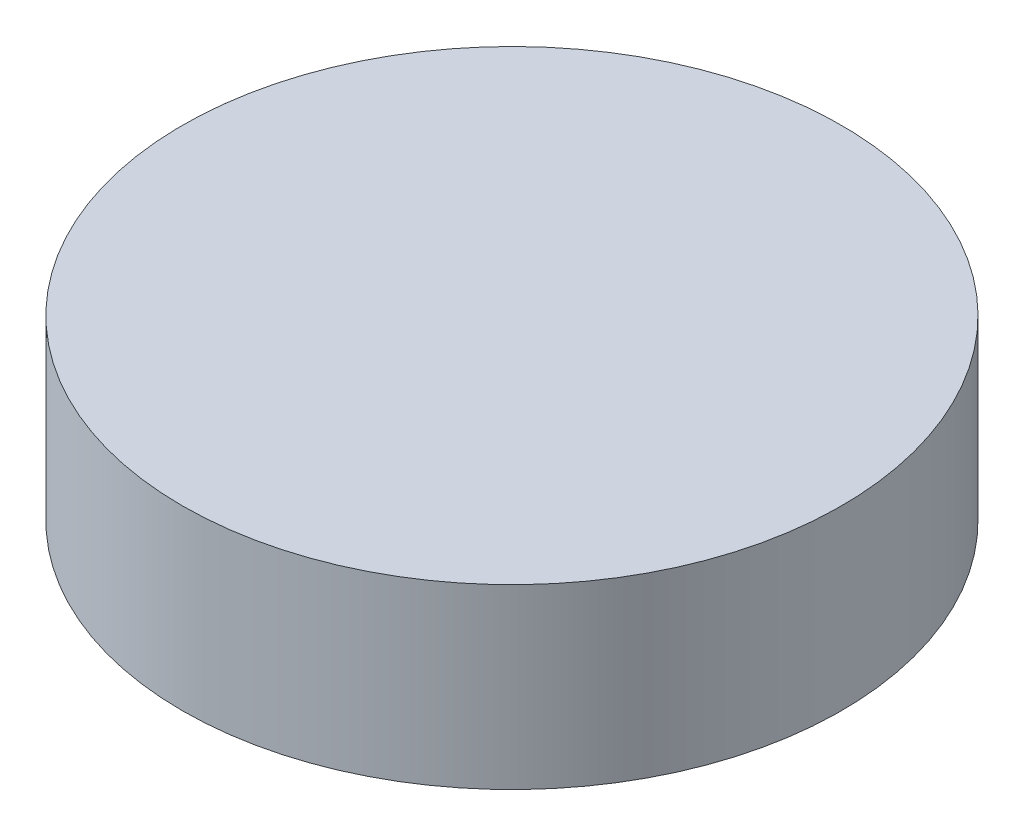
SolidWorks part; units mm, degrees
ref_plane "Alzado" through (0, 0, 0) normal (0, 0, 1) x (1, 0, 0)
ref_plane "Planta" through (0, 0, 0) normal (0, 1, 0) x (1, 0, 0)
ref_plane "Vista lateral" through (0, 0, 0) normal (1, 0, 0) x (0, 0, -1)
sketch "Croquis1" plane through (0, 0, 0) normal (0, 1, 0) x (1, 0, 0)
  circle A0 centre (0, 0) radius 65
  dimension "D1" = 130
extrude "Saliente-Extruir1" add sketch "Croquis1" along normal blind 35
